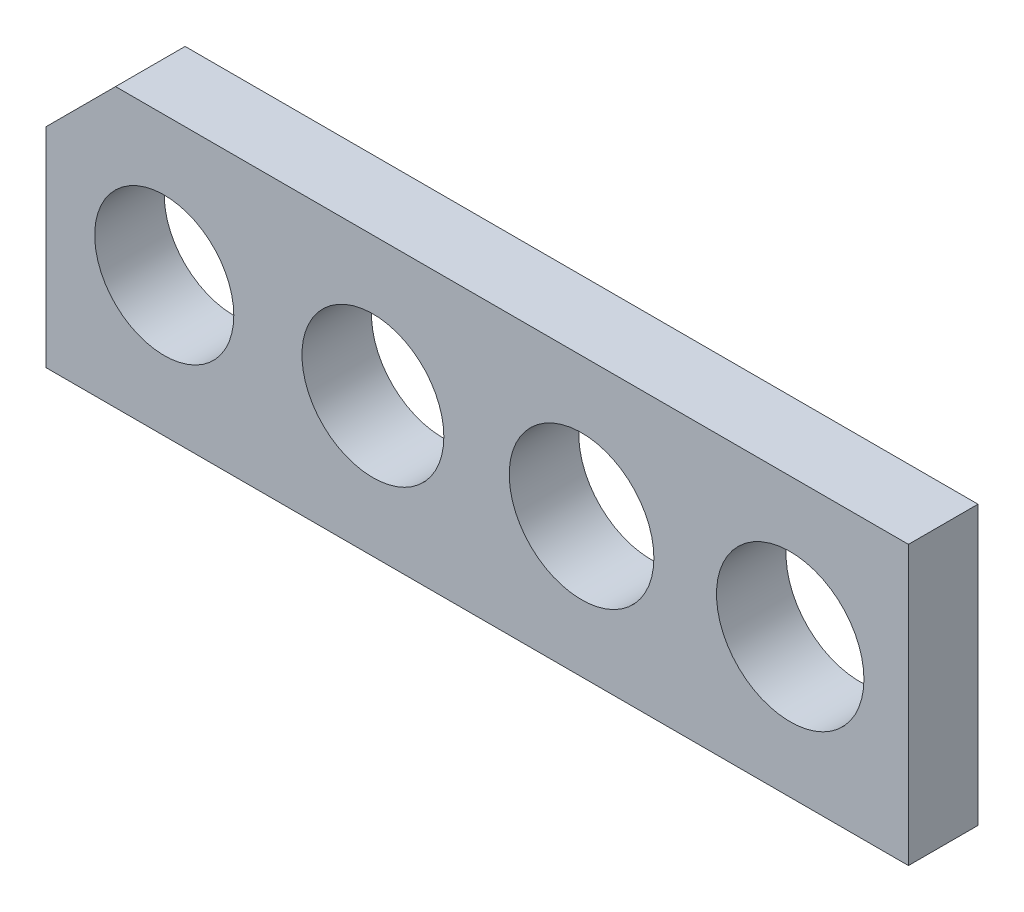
SolidWorks part; units mm, degrees
ref_plane "前视基准面" through (0, 0, 0) normal (0, 0, 1) x (1, 0, 0)
ref_plane "上视基准面" through (0, 0, 0) normal (0, 1, 0) x (1, 0, 0)
ref_plane "右视基准面" through (0, 0, 0) normal (1, 0, 0) x (0, 0, -1)
other "Configuration Table"
sketch "草图1" plane through (0, 0, 0) normal (0, 0, 1) x (1, 0, 0)
  line L0 (-31, -10) -> (31, -10)
  line L1 (31, -10) -> (31, 10)
  line L2 (31, 10) -> (-26, 10)
  line L3 (-26, 10) -> (-31, 5)
  line L4 (-31, 5) -> (-31, -10)
  circle A0 centre (-22.5, 0) radius 5
  circle A1 centre (-7.5, 0) radius 5.1
  circle A2 centre (7.5, 0) radius 5.2
  circle A3 centre (22.5, 0) radius 5.3
  dimension "D1" = 10.2
  dimension "D2" = 10
  dimension "D3" = 10.6
  dimension "D4" = 10.4
  dimension "D5" = 7.5
  dimension "D6" = 22.5
  dimension "D7" = 31
  dimension "D8" = 7.5
  dimension "D9" = 22.5
  dimension "D10" = 26
  dimension "D11" = 31
  dimension "D12" = 5
  dimension "D13" = 10
  dimension "D14" = 10
extrude "Four_clearance_trials" add sketch "草图1" along normal blind 5
